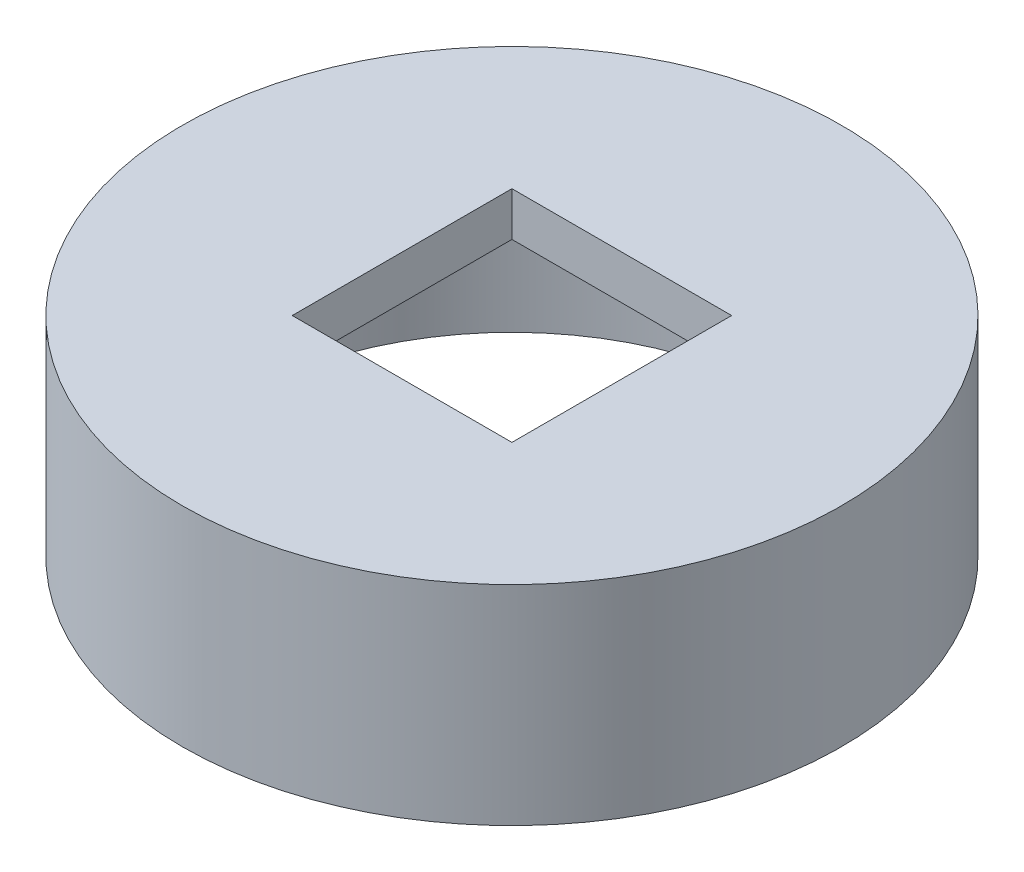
SolidWorks part; units mm, degrees
ref_plane "Front Plane" through (0, 0, 0) normal (0, 0, 1) x (1, 0, 0)
ref_plane "Top Plane" through (0, 0, 0) normal (0, 1, 0) x (1, 0, 0)
ref_plane "Right Plane" through (0, 0, 0) normal (1, 0, 0) x (0, 0, -1)
sketch "Sketch2" plane through (0, 0, 0) normal (0, 1, 0) x (1, 0, 0)
  circle A0 centre (0, 0) radius 50
  circle A1 centre (0, 0) radius 60
  dimension "D1" = 120
  dimension "D2" = 100
extrude "Boss-Extrude1" add sketch "Sketch2" along normal blind 30
sketch "Sketch3" plane through (0, 30, 0) normal (0, 1, 0) x (1, 0, 0)
  circle A0 centre (0, 0) radius 60
extrude "Boss-Extrude2" add sketch "Sketch3" along normal blind 8
sketch "Sketch4" plane through (0, 0, 0) normal (0, -1, 0) x (1, 0, 0)
  point P0 (-55, 0)
  point P5 (0, 55)
  point P6 (55, 0)
  point P7 (0, -55)
  point P8 (0, 0)
  dimension "D1" = 55
  dimension "D2" = 4
sketch "Sketch5" plane through (0, 38, 0) normal (0, 1, 0) x (1, 0, 0)
  line L1 (20, 20) -> (-20, 20)
  line L2 (20, 20) -> (20, -20)
  line L3 (20, -20) -> (-20, -20)
  line L4 (-20, 20) -> (-20, -20)
  dimension "D1" = 40
  dimension "D2" = 20
  dimension "D3" = 20
extrude "Cut-Extrude1" cut sketch "Sketch5" against normal through all
